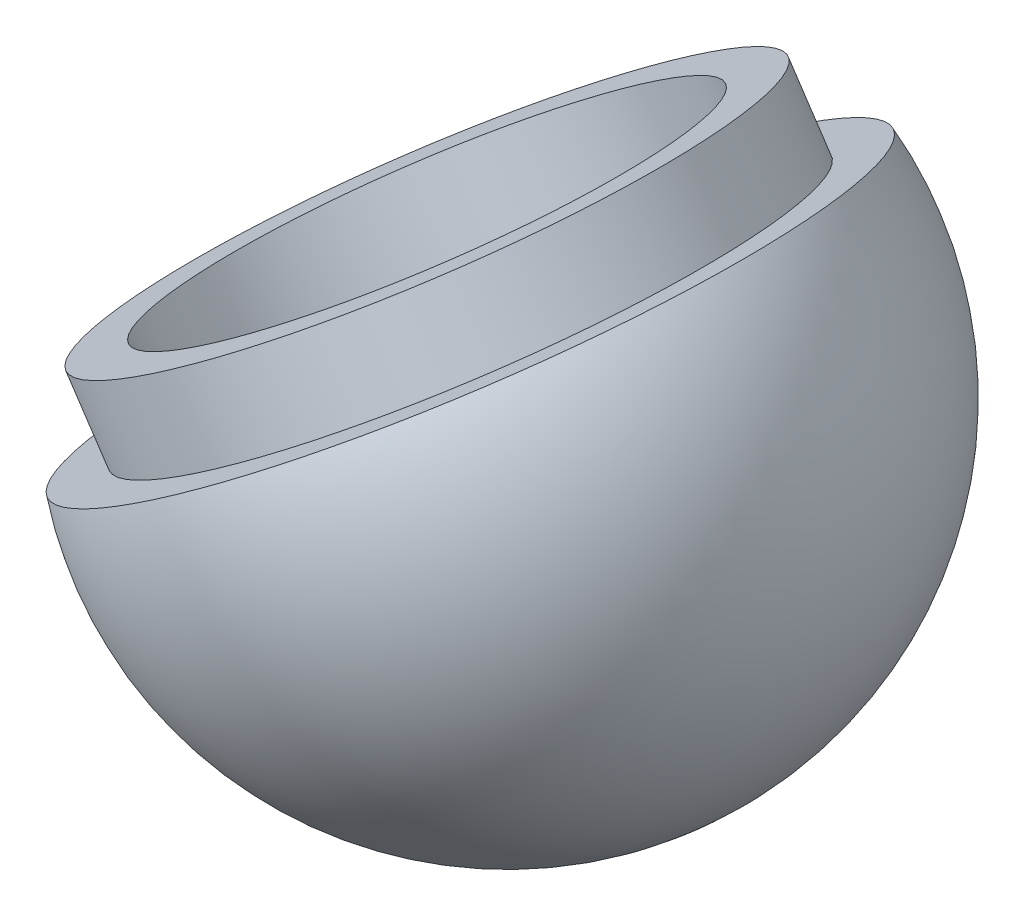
SolidWorks part; units mm, degrees
ref_plane "Płaszczyzna przednia" through (0, 0, 0) normal (0, 0, 1) x (1, 0, 0)
ref_plane "Płaszczyzna górna" through (0, 0, 0) normal (0, 1, 0) x (1, 0, 0)
ref_plane "Płaszczyzna prawa" through (0, 0, 0) normal (1, 0, 0) x (0, 0, -1)
sketch "Szkic1" plane through (0, 0, 0) normal (0, 0, 1) x (1, 0, 0)
  line L0 (35.1495, 35.56) -> (-46.2741, -18.9395)
  line L1 (-27.8116, 41.5513) -> (0, 0) construction
  line L2 (0, 0) -> (43.6504, -65.2148) construction
  line L3 (0, 50) -> (0, -60.8615) construction
  circle A0 centre (0, 0) radius 50
  point P8 (-27.8116, 41.5513)
  dimension "D1" = 100
  dimension "D2" = 40
  dimension "D3" = 38
sketch "Szkic3" plane through (0, 0, 0) normal (0, 0, 1) x (1, 0, 0)
  line L0 (-27.8116, 41.5513) -> (0, 0) construction
  line L3 (-27.8116, 41.5513) -> (0, 0) construction
  line L4 (35.1495, 35.56) -> (29.1921, 31.5725)
  line L5 (35.1495, 35.56) -> (-46.2741, -18.9395) construction
  line L6 (29.1921, 31.5725) -> (22.6945, 41.28)
  line L7 (22.6945, 41.28) -> (-10.0413, 41.8111)
  line L8 (-10.0413, 41.8111) -> (-23.918, 35.7341)
  line L9 (-27.8116, 41.5513) -> (-23.918, 35.7341)
  circle A0 centre (0, 0) radius 50 construction
  arc A1 (35.1495, 35.56) -> (-27.8116, 41.5513) centre (0, 0) ccw
sketch "Szkic4" plane through (0, 0, 0) normal (0, 0, 1) x (1, 0, 0)
  line L0 (0, 49.305) -> (6.9806, 49.305)
  line L1 (0, 50) -> (0, -60.8615) construction
  line L2 (6.9806, 49.305) -> (6.9806, 78.7656)
  line L3 (6.9806, 78.7656) -> (0, 78.7656)
  line L4 (0, 78.7656) -> (0, 49.305)
sketch "Szkic8" plane through (0, 0, 0) normal (0, 0, 1) x (1, 0, 0)
  line L0 (35.1495, 35.56) -> (-46.2741, -18.9395) construction
  line L1 (0, 0) -> (43.6504, -65.2148) construction
  line L2 (-27.8116, 41.5513) -> (0, 0) construction
  line L3 (35.1495, 35.56) -> (29.1921, 31.5725)
  line L4 (0, 0) -> (43.6504, -65.2148) construction
  line L5 (-27.8116, 41.5513) -> (0, 0) construction
  line L6 (29.1921, 31.5725) -> (22.6945, 41.28)
  line L7 (22.6945, 41.28) -> (16.6797, 37.2541)
  line L8 (16.6797, 37.2541) -> (23.1773, 27.5466)
  line L9 (20.0244, -29.917) -> (27.8116, -41.5513)
  circle A0 centre (0, 0) radius 50 construction
  arc A1 (27.8116, -41.5513) -> (35.1495, 35.56) centre (0, 0) ccw
  arc A3 (20.0244, -29.917) -> (23.1773, 27.5466) centre (0, 0) ccw
  circle A4 centre (0, 0) radius 36 construction
  circle A5 centre (0, 0) radius 50 construction
  dimension "D1" = 14
revolve "Obrót3" add sketch "Szkic8" angle 360 about L4
